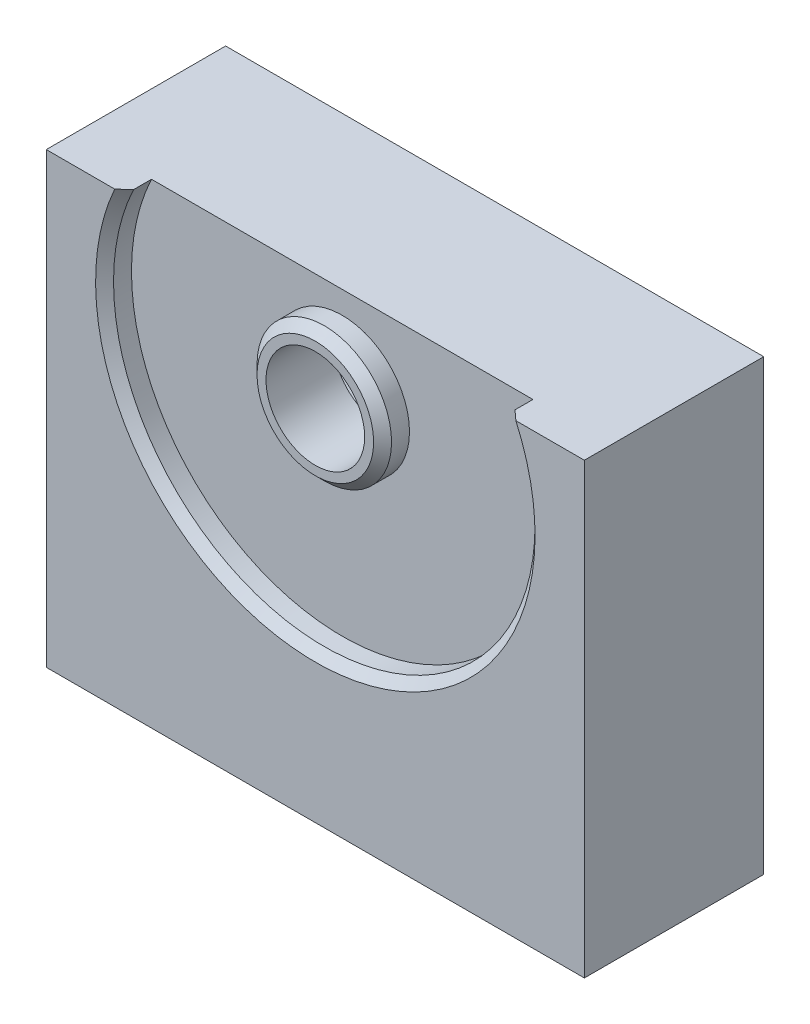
SolidWorks part; units mm, degrees
ref_plane "Plan de face" through (0, 0, 0) normal (0, 0, 1) x (1, 0, 0)
ref_plane "Plan de dessus" through (0, 0, 0) normal (0, 1, 0) x (1, 0, 0)
ref_plane "Plan de droite" through (0, 0, 0) normal (1, 0, 0) x (0, 0, -1)
sketch "Esquisse1" plane through (0, 0, 0) normal (0, 0, 1) x (1, 0, 0)
  line L1 (0, 0) -> (60, 0)
  line L2 (0, 0) -> (0, 50)
  line L3 (0, 50) -> (60, 50)
  line L4 (60, 0) -> (60, 50)
  dimension "D1" = 50
  dimension "D2" = 60
extrude "Boss.-Extru.1" add sketch "Esquisse1" along normal blind 20
sketch "Esquisse2" plane through (0, 0, 20) normal (0, 0, 1) x (1, 0, 0)
  line L0 (30, 50) -> (30, 0) construction
  line L1 (60, 50) -> (0, 50) construction
  line L2 (0, 0) -> (60, 0) construction
  circle A0 centre (30, 40) radius 7.5
  circle A1 centre (30, 40) radius 23.5
  dimension "D1" = 15
  dimension "D3" = 47
  dimension "D2" = 10
extrude "Enlèv. mat.-Extru.1" cut sketch "Esquisse2" against normal blind 3
chamfer "Chanfrein1" distance 1 angle 45 2 edges at (30, 16.5, 20) (37.5, 40, 20)
hole_wizard "Diamètre du perçage Ø11.0 (11)1" positions "Esquisse4" profile "Esquisse3" hole size "Ø11.0" standard "Ansi Metric"
sketch "Esquisse4" plane through (0, 0, 20) normal (0, 0, 1) x (1, 0, 0)
  point P0 (30, 40)
sketch "Esquisse3" plane through (30, 40, 20) normal (1, 0, 0) x (0, -1, 0)
  line L0 (0, 0) -> (0, 10.8047)
  line L1 (0, 10.8047) -> (5.5, 7.5)
  line L2 (5.5, 7.5) -> (5.5, 0)
  line L5 (5.5, 0) -> (0, 0)
  line L10 (0, 10.8047) -> (-5.5, 7.5) construction
  line L11 (0, -6.35) -> (0, 107.95) construction
  dimension "Diamètre du perçage" = 11
  dimension "Profondeur du perçage" = 7.5
  dimension "Angle de pointe" = 118
